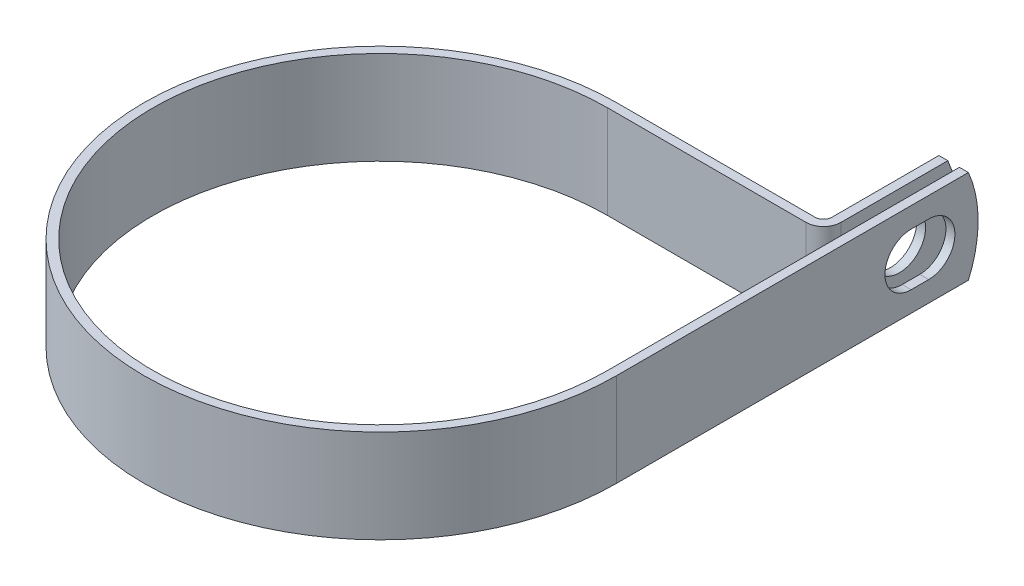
SolidWorks part; units mm, degrees
ref_plane "Front Plane" through (0, 0, 0) normal (0, 0, 1) x (1, 0, 0)
ref_plane "Top Plane" through (0, 0, 0) normal (0, 1, 0) x (1, 0, 0)
ref_plane "Right Plane" through (0, 0, 0) normal (1, 0, 0) x (0, 0, -1)
sketch "Sketch1" plane through (0, 0, 0) normal (0, 1, 0) x (1, 0, 0)
  line L0 (0, 30.9499) -> (26.9977, 30.9499)
  line L1 (30.9499, 0) -> (30.9499, 30.9499)
  line L2 (29.3751, 49.1998) -> (29.3751, 33.3273)
  line L5 (30.9499, 30.9499) -> (30.9499, 49.1998)
  arc A0 (0, 30.9499) -> (30.9499, 0) centre (0, 0) ccw
  arc A3 (26.9977, 30.9499) -> (29.3751, 33.3273) centre (26.9977, 33.3273) ccw
extrude "Extrude-Thin1" add sketch "Sketch1" along normal mid plane 12.7 thin
sketch "Sketch2" plane through (28.1559, 0, 0) normal (-1, 0, 0) x (0, 0, 1)
  line L0 (-49.1998, 6.35) -> (-49.1998, -6.35) construction
  line L7 (0, 6.35) -> (0, -6.35) construction
  circle A0 centre (-41.275, 0) radius 3.5687
  point P2 (-49.1998, 0)
extrude "Cut-Extrude1" cut sketch "Sketch2" against normal up to surface (1.2192 mm away)
sketch "Sketch3" plane through (32.1691, 0, 0) normal (1, 0, 0) x (0, 0, -1)
  line L0 (40.0812, 0) -> (42.4688, 0) construction
  line L1 (40.0812, 3.5687) -> (42.4688, 3.5687)
  line L2 (40.0812, -3.5687) -> (42.4688, -3.5687)
  line L3 (49.1998, 6.35) -> (49.1998, -6.35) construction
  arc A0 (40.0812, 3.5687) -> (40.0812, -3.5687) centre (40.0812, 0) ccw
  arc A1 (42.4688, -3.5687) -> (42.4688, 3.5687) centre (42.4688, 0) ccw
  point P3 (41.275, 0)
  point P8 (49.1998, 0)
  point P11 (36.5125, 0)
  point P12 (46.0375, 0)
extrude "Cut-Extrude2" cut sketch "Sketch3" against normal up to surface (1.2192 mm away)
sketch "Sketch4" plane through (28.1559, 0, 0) normal (-1, 0, 0) x (0, 0, 1)
  line L0 (-49.1998, 6.35) -> (-49.1998, -6.35)
  line L1 (-49.1998, 6.35) -> (-47.8745, 6.35)
  line L2 (-49.1998, 6.35) -> (-33.3273, 6.35) construction
  line L3 (-49.1998, -6.35) -> (-47.8745, -6.35)
  line L4 (-49.1998, -6.35) -> (-33.3273, -6.35) construction
  arc A0 (-47.8745, 6.35) -> (-47.8745, -6.35) centre (-33.3248, 0) ccw
extrude "Cut-Extrude3" cut sketch "Sketch4" against normal through all contours A0 M4 M5 | A0 L0 M2
equation "\"D1@Sketch3\" = \"D2@Sketch2\""
equation "\"D7@Sketch1\" = \"D3@Sketch2\" + \"D1@Sketch3\""
equation "\"D1@Sketch4\" = ( \"D1@Extrude-Thin1\" + .125 ) * 2"
equation "\"D2@Sketch1\"=1.95*\"D5@Extrude-Thin1\""
equation "\"D2@Sketch3\" = \"D1@Sketch2\""
